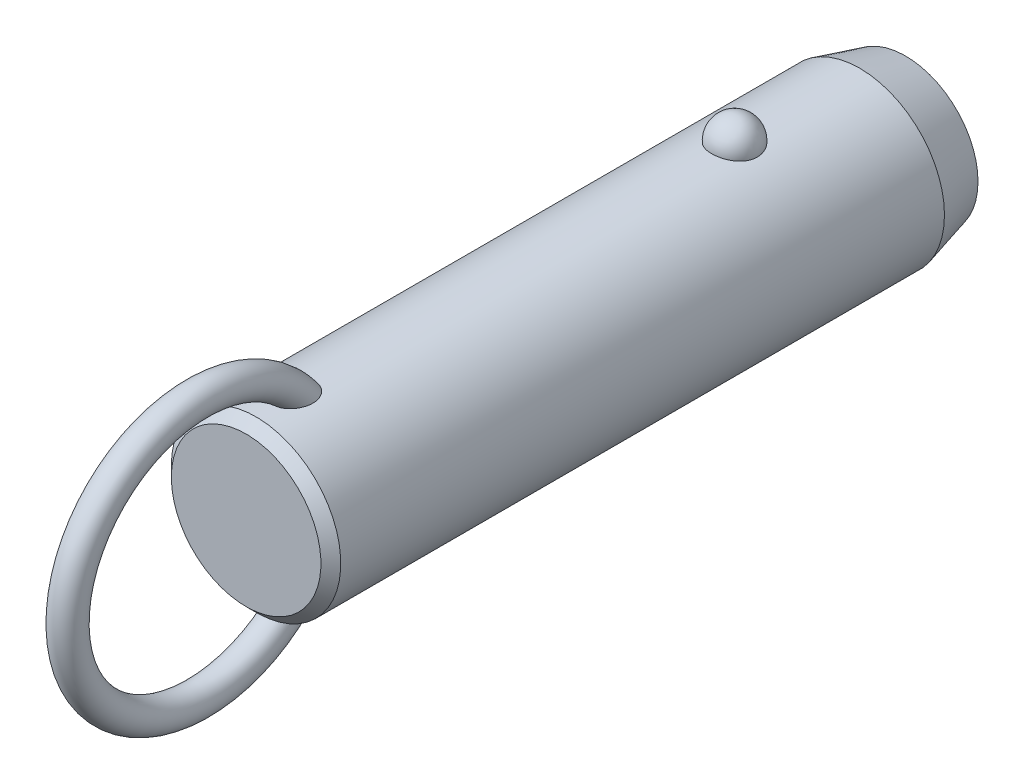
SolidWorks part; units mm, degrees
ref_plane "Front Plane" through (0, 0, 0) normal (0, 0, 1) x (1, 0, 0)
ref_plane "Top Plane" through (0, 0, 0) normal (0, 1, 0) x (1, 0, 0)
ref_plane "Right Plane" through (0, 0, 0) normal (1, 0, 0) x (0, 0, -1)
sketch "Sketch2" plane through (0, 0, 0) normal (0, 0, 1) x (1, 0, 0)
  circle A0 centre (0, 0) radius 11.1
  point P3 (0, 11.1)
  dimension "D1" = 22.2
extrude "Boss-Extrude1" add sketch "Sketch2" along normal blind 48.3
sketch "Sketch3" plane through (0, 0, 0) normal (0, 0, -1) x (-1, 0, 0)
  circle A0 centre (0, 0) radius 11.1
  dimension "D1" = 22.2
extrude "Boss-Extrude2" add sketch "Sketch3" along normal blind 25.4
chamfer "Chamfer1" distance 6 angle 15 1 edges at (-11.1, 0, -25.4)
sketch "Sketch12" plane through (0, 0, 0) normal (1, 0, 0) x (0, 0, -1)
  line L0 (-48.3, 11.1) -> (-48.3, -11.1) construction
  point P0 (-48.3, 0)
sketch "Sketch13" plane through (0, 0, 0) normal (1, 0, 0) x (0, 0, -1)
  circle A0 centre (-67.35, 0) radius 19.05
  point P2 (-48.3, 0)
  dimension "D1" = 38.1
sketch "Sketch14" plane through (0, 0, 0) normal (0, 1, 0) x (1, 0, 0)
  circle A0 centre (0, -50.3) radius 2
  point P2 (0, -48.3)
  dimension "D1" = 4
sweep "Sweep1" add profiles "Sketch14" path "Sketch13"
sketch "Sketch15" plane through (0, 0, 48.3) normal (0, 0, 1) x (1, 0, 0)
  circle A0 centre (0, 0) radius 11.1
  dimension "D1" = 22.2
extrude "Boss-Extrude3" add sketch "Sketch15" along normal blind 12.7
chamfer "Chamfer2" distance 1.3 angle 45 1 edges at (11.1, 0, 61)
sketch "Sketch18" plane through (0, 0, 0) normal (1, 0, 0) x (0, 0, -1)
  line L0 (19.4, 11.1) -> (-51.868, 11.1) construction
  line L1 (3, 14.1) -> (3, 8.1)
  line L2 (-51.868, -11.1) -> (19.4, -11.1) construction
  arc A0 (3, 14.1) -> (3, 8.1) centre (3, 11.1) ccw
  point P4 (0, 11.1)
  dimension "D1" = 25.2
revolve "Revolve1" add sketch "Sketch18" angle 360 about L1
